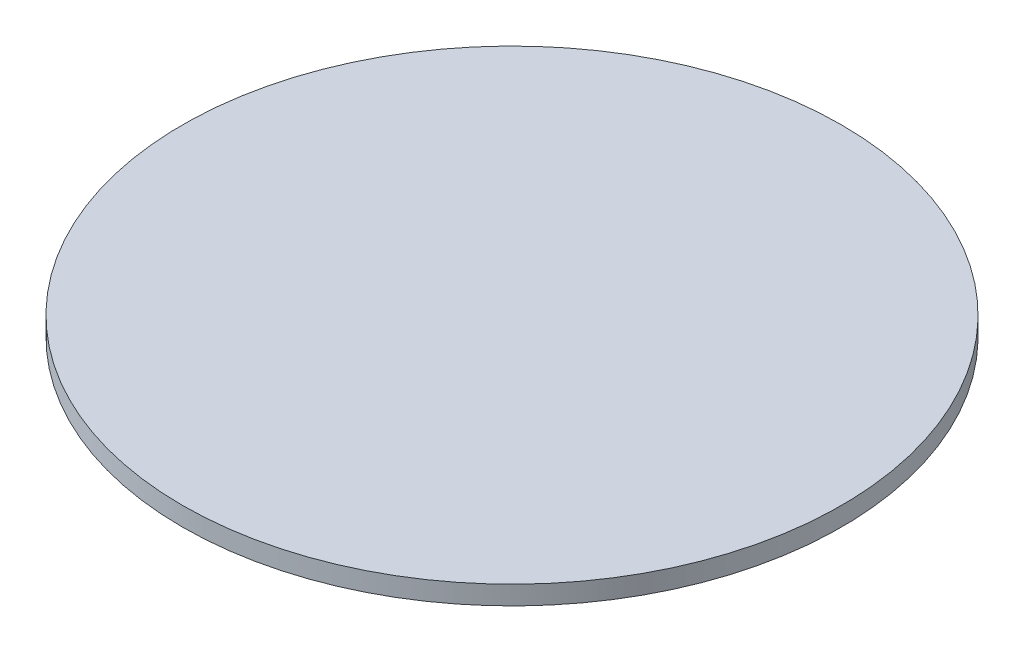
SolidWorks part; units mm, degrees
ref_plane "Front Plane" through (0, 0, 0) normal (0, 0, 1) x (1, 0, 0)
ref_plane "Top Plane" through (0, 0, 0) normal (0, 1, 0) x (1, 0, 0)
ref_plane "Right Plane" through (0, 0, 0) normal (1, 0, 0) x (0, 0, -1)
sketch "Sketch1" plane through (0, 0, 0) normal (0, 1, 0) x (1, 0, 0)
  line L1 (-50.8, 25.4) -> (50.8, 25.4) construction
  line L2 (-50.8, 25.4) -> (-50.8, -25.4) construction
  line L3 (-50.8, -25.4) -> (50.8, -25.4) construction
  line L4 (50.8, 25.4) -> (50.8, -25.4) construction
  line L5 (-50.8, 25.4) -> (50.8, -25.4) construction
  line L6 (-50.8, -25.4) -> (50.8, 25.4) construction
  circle A0 centre (0, 0) radius 44.45
  point P0 (0, 0)
  dimension "D3" = 88.9
  dimension "D1" = 50.8
  dimension "D2" = 101.6
extrude "Extrude1" add sketch "Sketch1" against normal blind 2.54
sketch "Sketch2" plane through (0, -2.54, 0) normal (0, -1, 0) x (-1, 0, 0)
  line L0 (-34.2016, 0) -> (34.2127, 0)
  line L1 (-34.2016, 0) -> (-34.2016, 42.8925) construction
  line L2 (0.0055, 0) -> (0.0055, 25.8623) construction
  line L8 (-18.3266, 15.875) -> (18.3377, 15.875)
  line L12 (-50.8, 0) -> (50.8, 0) construction
  line L14 (-50.8, 15.875) -> (50.8, 15.875) construction
  arc A0 (18.3377, 15.875) -> (34.2127, 0) centre (18.3377, 0) cw
  arc A1 (-18.3266, 15.875) -> (-34.2016, 0) centre (-18.3266, 0) ccw
  point P11 (0.0055, 15.875)
  dimension "D1" = 15.875
extrude "Extrude2" add sketch "Sketch2" along normal blind 6.35
fillet "Fillet1" radius 12.3952 3 edges at (-0.0055, -8.89, -15.875) (29.5519, -8.89, -11.2253) (-29.563, -8.89, -11.2253)
